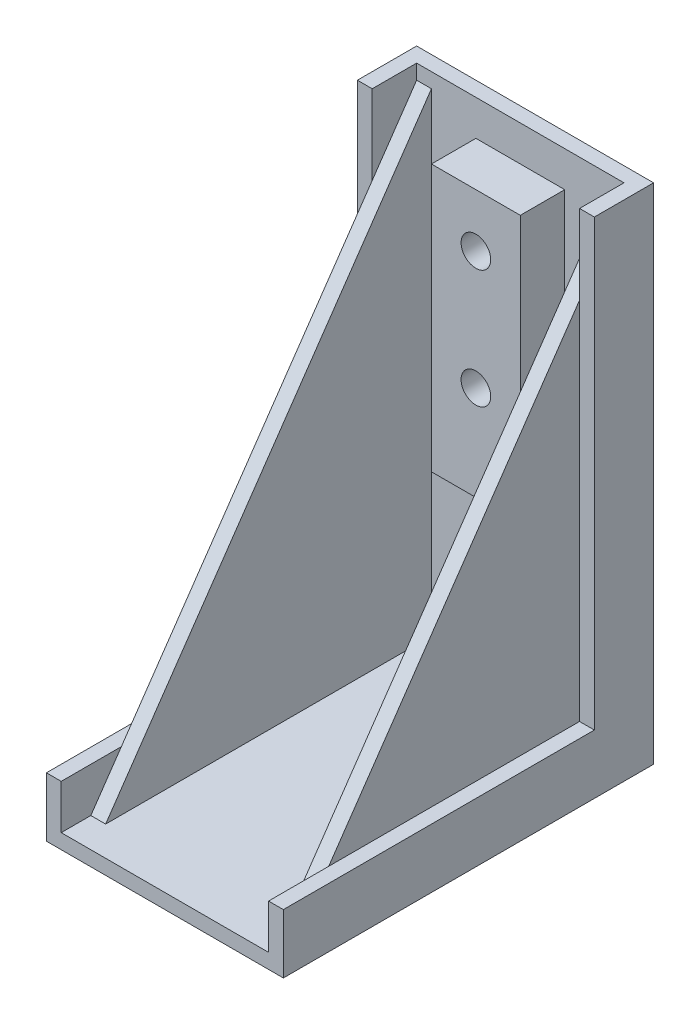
SolidWorks part; units mm, degrees
ref_plane "Front Plane" through (0, 0, 0) normal (0, 0, 1) x (1, 0, 0)
ref_plane "Top Plane" through (0, 0, 0) normal (0, 1, 0) x (1, 0, 0)
ref_plane "Right Plane" through (0, 0, 0) normal (1, 0, 0) x (0, 0, -1)
sketch "Sketch1" plane through (0, 0, 0) normal (1, 0, 0) x (0, 0, -1)
  line L0 (0, 0) -> (-30, 0)
  line L1 (-30, 0) -> (-30, -1.25)
  line L2 (-30, -1.25) -> (1.25, -1.25)
  line L3 (1.25, -1.25) -> (1.25, 41.25)
  line L4 (1.25, 41.25) -> (0, 41.25)
  line L5 (0, 41.25) -> (0, 0)
  dimension "D1" = 1.25
  dimension "D2" = 42.5
  dimension "D3" = 31.25
extrude "Boss-Extrude1" add sketch "Sketch1" along normal mid plane 17.5
sketch "Sketch2" plane through (8.75, 0, 0) normal (1, 0, 0) x (0, 0, -1)
  line L0 (-30, -1.25) -> (1.25, -1.25) construction
  line L1 (1.25, -1.25) -> (1.25, 41.25) construction
  line L2 (-30, -1.25) -> (1.25, -1.25)
  line L3 (1.25, -1.25) -> (1.25, 41.25)
  line L4 (-30, -1.25) -> (-30, 3.75)
  line L5 (-30, 3.75) -> (-3.75, 3.75)
  line L6 (-3.75, 3.75) -> (-3.75, 41.25)
  line L7 (-3.75, 41.25) -> (1.25, 41.25)
  dimension "D1" = 5
extrude "Boss-Extrude2" add sketch "Sketch2" along normal blind 1.25
sketch "Sketch3" plane through (-8.75, 0, 0) normal (-1, 0, 0) x (0, 0, 1)
  line L0 (30, -1.25) -> (-1.25, -1.25) construction
  line L1 (-1.25, -1.25) -> (-1.25, 41.25) construction
  line L2 (30, -1.25) -> (-1.25, -1.25)
  line L3 (-1.25, -1.25) -> (-1.25, 41.25)
  line L4 (30, 0) -> (30, -1.25) construction
  line L5 (30, 3.75) -> (30, 0) construction
  line L6 (3.75, 3.75) -> (30, 3.75) construction
  line L7 (3.75, 41.25) -> (3.75, 3.75) construction
  line L8 (0, 41.25) -> (3.75, 41.25) construction
  line L9 (-1.25, 41.25) -> (0, 41.25) construction
  line L10 (30, 0) -> (30, -1.25)
  line L11 (30, 3.75) -> (30, 0)
  line L12 (3.75, 3.75) -> (30, 3.75)
  line L13 (3.75, 41.25) -> (3.75, 3.75)
  line L14 (0, 41.25) -> (3.75, 41.25)
  line L15 (-1.25, 41.25) -> (0, 41.25)
extrude "Boss-Extrude3" add sketch "Sketch3" along normal blind 1.25
sketch "Sketch4" plane through (-8.75, 0, 0) normal (1, 0, 0) x (0, 0, -1)
  line L0 (0, 0) -> (0, 40)
  line L1 (0, 40) -> (-27.5, 0)
  line L2 (0, 0) -> (-30, 0) construction
  line L3 (-27.5, 0) -> (0, 0)
  dimension "D1" = 40
  dimension "D2" = 27.5
extrude "Boss-Extrude4" add sketch "Sketch4" along normal blind 1.25
sketch "Sketch5" plane through (8.75, 0, 0) normal (-1, 0, 0) x (0, 0, 1)
  line L0 (0, 0) -> (0, 40)
  line L1 (0, 41.25) -> (0, 0) construction
  line L2 (0, 40) -> (27.5, 0)
  line L3 (0, 0) -> (30, 0) construction
  line L4 (27.5, 0) -> (0, 0)
  dimension "D1" = 40
  dimension "D2" = 27.5
extrude "Boss-Extrude5" add sketch "Sketch5" along normal blind 1.25
sketch "Sketch6" plane through (0, 0, 0) normal (0, 0, 1) x (1, 0, 0)
  line L1 (-3.75, 38.25) -> (3.75, 38.25)
  line L2 (-3.75, 38.25) -> (-3.75, 15.75)
  line L3 (-3.75, 15.75) -> (3.75, 15.75)
  line L4 (3.75, 38.25) -> (3.75, 15.75)
  line L5 (8.75, 41.25) -> (-8.75, 41.25) construction
  point P4 (0, 38.25)
  dimension "D1" = 7.5
  dimension "D2" = 22.5
  dimension "D3" = 3
extrude "Boss-Extrude6" add sketch "Sketch6" along normal blind 3.75
sketch "Sketch7" plane through (0, 0, 3.75) normal (0, 0, 1) x (1, 0, 0)
  line L0 (8.75, 41.25) -> (-8.75, 41.25) construction
  circle A0 centre (0, 33.75) radius 1.25
  circle A1 centre (0, 23.75) radius 1.25
  dimension "D1" = 2.5
  dimension "D2" = 10
  dimension "D3" = 7.5
extrude "Cut-Extrude1" cut sketch "Sketch7" against normal through all
